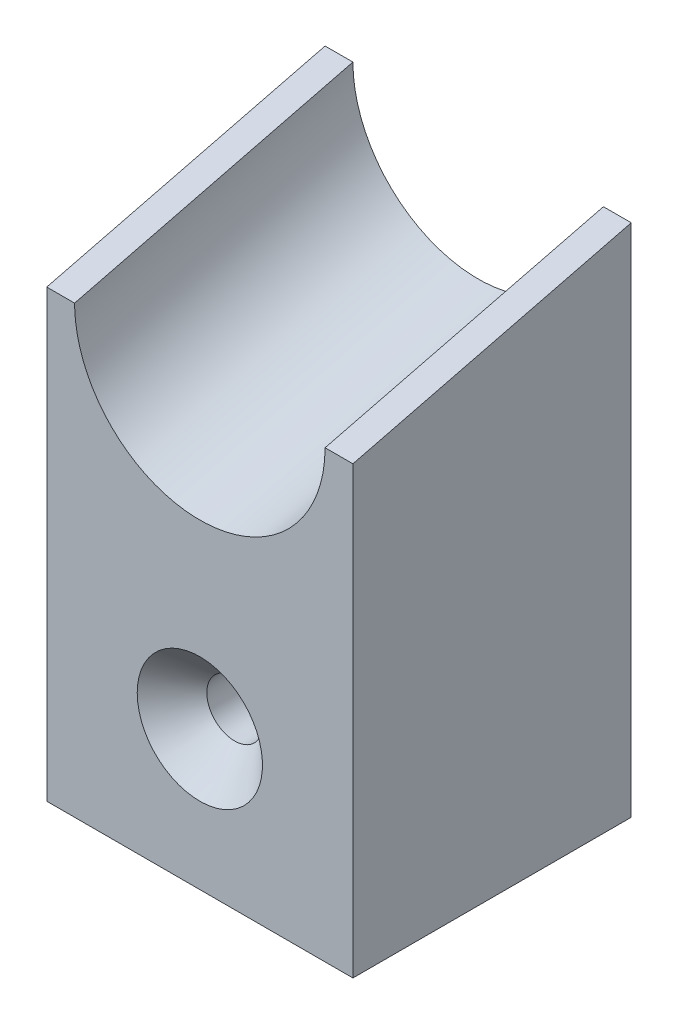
SolidWorks part; units mm, degrees
ref_plane "Front Plane" through (0, 0, 0) normal (0, 0, 1) x (1, 0, 0)
ref_plane "Top Plane" through (0, 0, 0) normal (0, 1, 0) x (1, 0, 0)
ref_plane "Right Plane" through (0, 0, 0) normal (1, 0, 0) x (0, 0, -1)
sketch "Sketch1" plane through (0, 0, 0) normal (0, 1, 0) x (1, 0, 0)
  line L1 (-11, 10) -> (11, 10)
  line L2 (-11, 10) -> (-11, -10)
  line L3 (-11, -10) -> (11, -10)
  line L4 (11, 10) -> (11, -10)
  line L5 (-11, 10) -> (11, -10) construction
  line L6 (-11, -10) -> (11, 10) construction
  point P0 (0, 0)
  dimension "D1" = 22
  dimension "D2" = 20
extrude "Extrude1" add sketch "Sketch1" along normal blind 37
sketch "Sketch3" plane through (0, 0, 0) normal (1, 0, 0) x (0, 0, -1)
  line L0 (10, 37) -> (-10, 32)
  line L1 (-10, 37) -> (-10, 0) construction
  dimension "D1" = 5
extrude "Extrude2" cut sketch "Sketch3" against normal through all and the other way through all flip side to cut
sketch "Sketch4" plane through (0, 0, -10) normal (0, 0, -1) x (-1, 0, 0)
  line L0 (-11, 37) -> (11, 37) construction
  circle A0 centre (0, 37) radius 9
  dimension "D1" = 9
extrude "Extrude3" cut sketch "Sketch4" along direction (0, -0.2425, 0.9701) on the side against the normal blind 37
sketch "Sketch5" plane through (0, 0, 0) normal (0, -1, 0) x (1, 0, 0)
  point P0 (0, 0)
hole_wizard "Ø8.0 (8) Diameter Hole1" positions "Sketch7" profile "Sketch6" hole size "Ø8.0" standard "DIN"
sketch "Sketch7" plane through (0, 0, 0) normal (0, -1, 0) x (1, 0, 0)
  point P1 (0, 0)
sketch "Sketch6" plane through (0, 0, 0) normal (1, 0, 0) x (0, 0, -1)
  line L0 (0, 0) -> (0, 21.4034)
  line L1 (0, 21.4034) -> (4, 19)
  line L2 (4, 19) -> (4, 0)
  line L5 (4, 0) -> (0, 0)
  line L10 (0, 21.4034) -> (-4, 19) construction
  line L11 (0, -6.35) -> (0, 107.95) construction
  dimension "Hole Dia." = 8
  dimension "Hole Depth" = 19
  dimension "Drill Angle" = 118
sketch "Sketch8" plane through (0, 0, 10) normal (0, 0, 1) x (1, 0, 0)
  line L0 (-11, 0) -> (11, 0) construction
  circle A0 centre (0, 10) radius 2
  dimension "D1" = 4
  dimension "D2" = 10
extrude "Extrude4" cut sketch "Sketch8" against normal up to surface (6.5359 mm away)
chamfer "Chamfer1" distance 2.5 angle 45 1 edges at (2, 10, 10)
